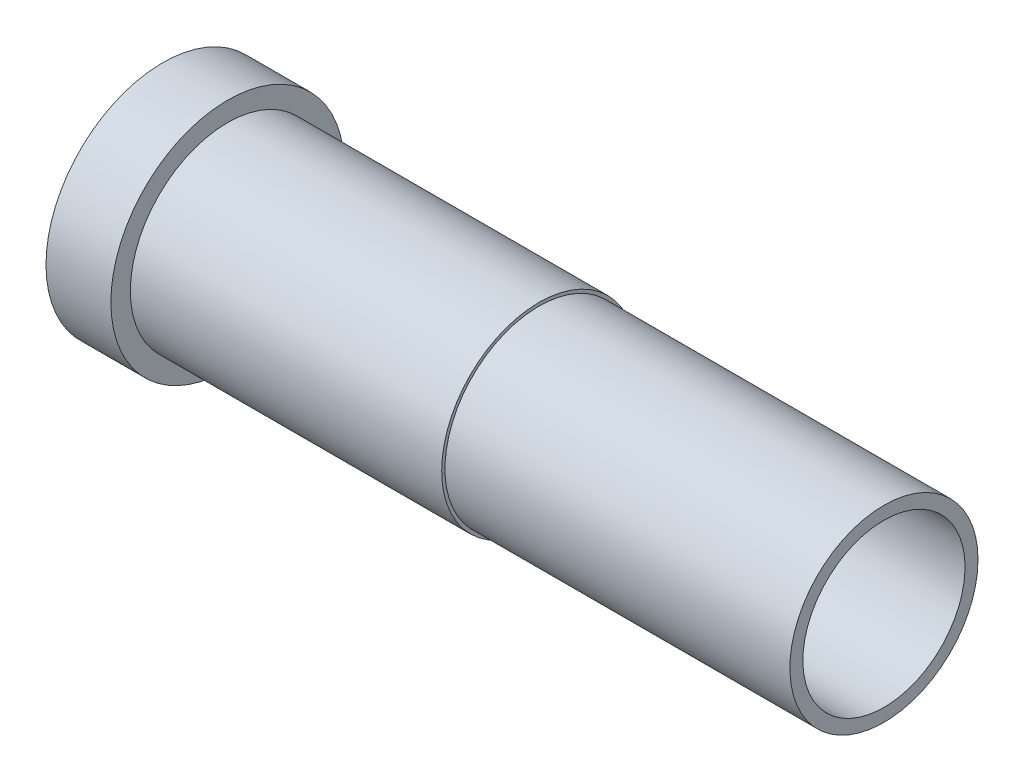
SolidWorks part; units mm, degrees
ref_plane "Plan de face" through (0, 0, 0) normal (0, 0, 1) x (1, 0, 0)
ref_plane "Plan de dessus" through (0, 0, 0) normal (0, 1, 0) x (1, 0, 0)
ref_plane "Plan de droite" through (0, 0, 0) normal (1, 0, 0) x (0, 0, -1)
sketch "Esquisse1" plane through (0, 0, 0) normal (0, 0, 1) x (1, 0, 0)
  line L0 (-21.6393, 0) -> (77.4742, 0) construction
  line L1 (0, 6.25) -> (0, 9)
  line L2 (0, 9) -> (5, 9)
  line L3 (5, 9) -> (5, 7.5)
  line L4 (5, 7.5) -> (59, 7.5)
  line L5 (59, 7.5) -> (59, 6.25)
  line L6 (59, 6.25) -> (0, 6.25)
  dimension "D1" = 5
  dimension "D2" = 18
  dimension "D3" = 12.5
  dimension "D4" = 15
  dimension "D5" = 59
revolve "Révolution1" add sketch "Esquisse1" angle 360 about L0
chamfer "Chanfrein1" distance 0.5 angle 45 1 edges at (0, 0, 6.25)
sketch "Esquisse2" plane through (59, 0, 0) normal (1, 0, 0) x (0, 0, -1)
  circle A0 centre (0, 0) radius 7.25
  dimension "D1" = 14.5
extrude "Enlèv. mat.-Extru.1" cut sketch "Esquisse2" against normal blind 30 flip side to cut
sketch "Esquisse3" plane through (59, 0, 0) normal (1, 0, 0) x (0, 0, -1)
  circle A0 centre (0, 0) radius 7.25
  circle A1 centre (0, 0) radius 7.25 construction
extrude "Enlèv. mat.-Extru.2" cut sketch "Esquisse3" against normal up to surface (3.4134 mm away)
